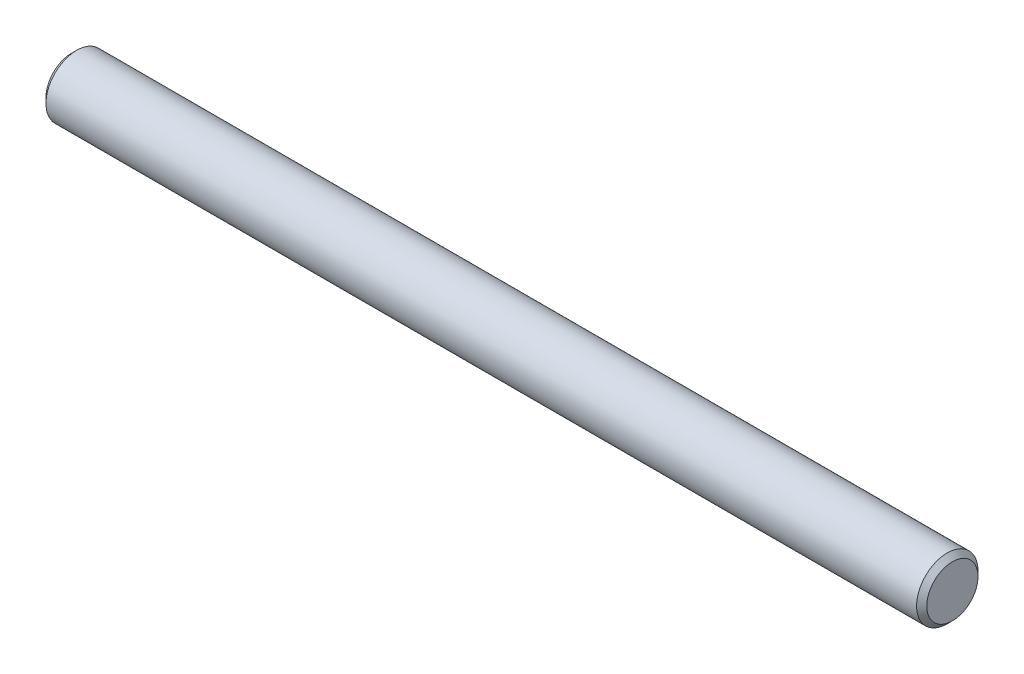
SolidWorks part; units mm, degrees
ref_plane "Front" through (0, 0, 0) normal (0, 0, 1) x (1, 0, 0)
ref_plane "Top" through (0, 0, 0) normal (0, 1, 0) x (1, 0, 0)
ref_plane "Right" through (0, 0, 0) normal (1, 0, 0) x (0, 0, -1)
sketch "Sketch1" plane through (0, 0, 0) normal (1, 0, 0) x (0, 0, -1)
  circle A0 centre (0, 0) radius 6
  dimension "D1" = 12
extrude "Extrude1" add sketch "Sketch1" along normal blind 172
chamfer "Chamfer1" distance 1 angle 45 2 edges at (0, 0, -6) (172, 0, -6)
